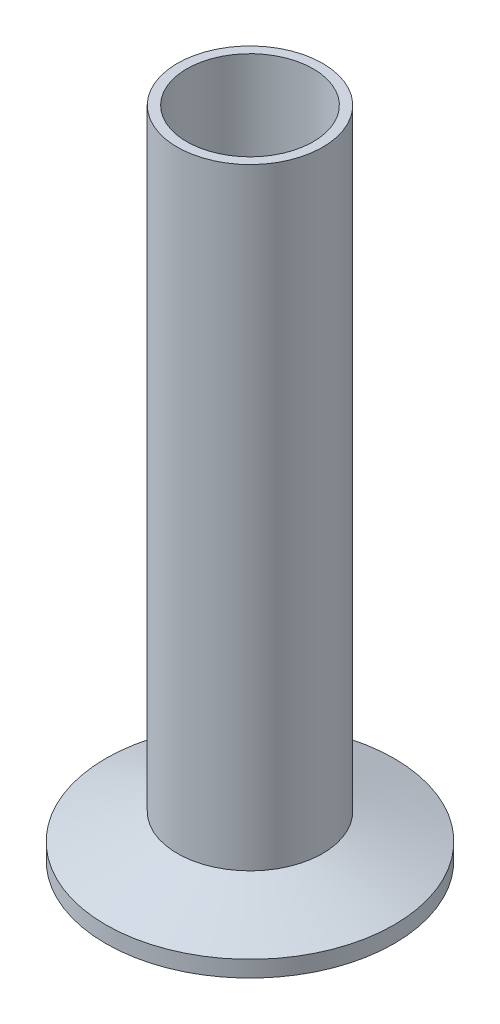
SolidWorks part; units mm, degrees
ref_plane "Front Plane" through (0, 0, 0) normal (0, 0, 1) x (1, 0, 0)
ref_plane "Top Plane" through (0, 0, 0) normal (0, 1, 0) x (1, 0, 0)
ref_plane "Right Plane" through (0, 0, 0) normal (1, 0, 0) x (0, 0, -1)
sketch "Sketch1" plane through (0, 0, 0) normal (0, 0, 1) x (1, 0, 0)
  line L0 (0, 0) -> (0, 114.3) construction
  line L1 (0, 114.3) -> (-12.7, 114.3)
  line L2 (-12.7, 114.3) -> (-12.7, 7.3933)
  line L3 (-12.7, 7.3933) -> (-25.1968, 2.8448)
  line L4 (-25.1968, 2.8448) -> (-25.1968, 0)
  line L5 (-25.1968, 0) -> (-23.6366, 0)
  line L6 (-20.0006, 0) -> (0, 0)
  line L7 (0, 0) -> (0, 114.3)
  line L8 (0, 114.3) -> (-11.049, 114.3)
  line L9 (-11.049, 114.3) -> (-11.049, 0)
  line L10 (-11.049, 0) -> (0, 0)
  line L11 (0, 0) -> (-0.1846, 0.0129)
  arc A0 (-22.9141, 0.4745) -> (-20.7231, 0.4745) centre (-21.8186, 0) cw
  arc A1 (-20.0006, 0) -> (-20.7231, 0.4745) centre (-20.0006, 0.7874) cw
  arc A2 (-22.9141, 0.4745) -> (-23.6366, 0) centre (-23.6366, 0.7874) cw
  point P12 (-20.6248, 0)
  dimension "D1" = 12.7
  dimension "D2" = 7.3933
  dimension "D3" = 25.1968
  dimension "D8" = 1.651
  dimension "D9" = 114.3
revolve "Revolve2" add sketch "Sketch1" angle 360 about L0
